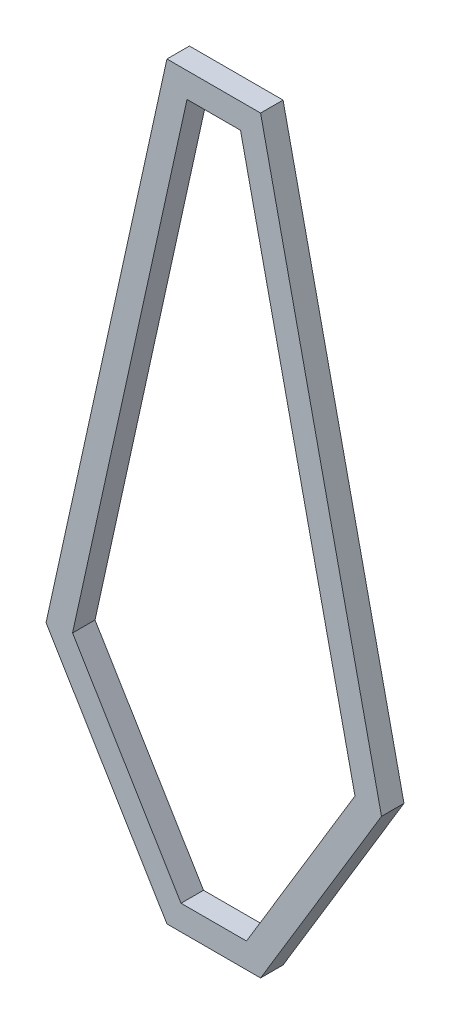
SolidWorks part; units mm, degrees
ref_plane "Plan de face" through (0, 0, 0) normal (0, 0, 1) x (1, 0, 0)
ref_plane "Plan de dessus" through (0, 0, 0) normal (0, 1, 0) x (1, 0, 0)
ref_plane "Plan de droite" through (0, 0, 0) normal (1, 0, 0) x (0, 0, -1)
sketch "Esquisse1" plane through (0, 0, 0) normal (0, 0, 1) x (1, 0, 0)
  line L0 (37.5, 0) -> (-37.5, 0)
  line L1 (-37.5, 0) -> (-134.3553, -439.4531)
  line L2 (0, 0) -> (0, -600) construction
  line L3 (37.5, -600) -> (-37.5, -600)
  line L4 (-134.3553, -439.4531) -> (-37.5, -600)
  line L5 (37.5, 0) -> (134.3553, -439.4531)
  line L6 (134.3553, -439.4531) -> (37.5, -600)
  dimension "D1" = 75
  dimension "D2" = 450
  dimension "D3" = 600
  dimension "D5" = 187.5
extrude "Boss.-Extru.1" add sketch "Esquisse1" along normal blind 18
sketch "Esquisse2" plane through (0, 0, 18) normal (0, 0, 1) x (1, 0, 0)
  line L12 (-21.428, -20) -> (-113.1053, -435.9595)
  line L13 (-113.1053, -435.9595) -> (-26.208, -580)
  line L14 (-26.208, -580) -> (26.208, -580)
  line L15 (26.208, -580) -> (113.1053, -435.9595)
  line L16 (113.1053, -435.9595) -> (21.428, -20)
  line L17 (21.428, -20) -> (-21.428, -20)
  line L18 (-21.428, -20) -> (-113.1053, -435.9595)
  line L19 (-113.1053, -435.9595) -> (-26.208, -580)
  line L20 (-26.208, -580) -> (26.208, -580)
  line L21 (26.208, -580) -> (113.1053, -435.9595)
  line L22 (113.1053, -435.9595) -> (21.428, -20)
  line L23 (21.428, -20) -> (-21.428, -20)
  dimension "D1" = 20
extrude "Enlèv. mat.-Extru.1" cut sketch "Esquisse2" against normal through all
